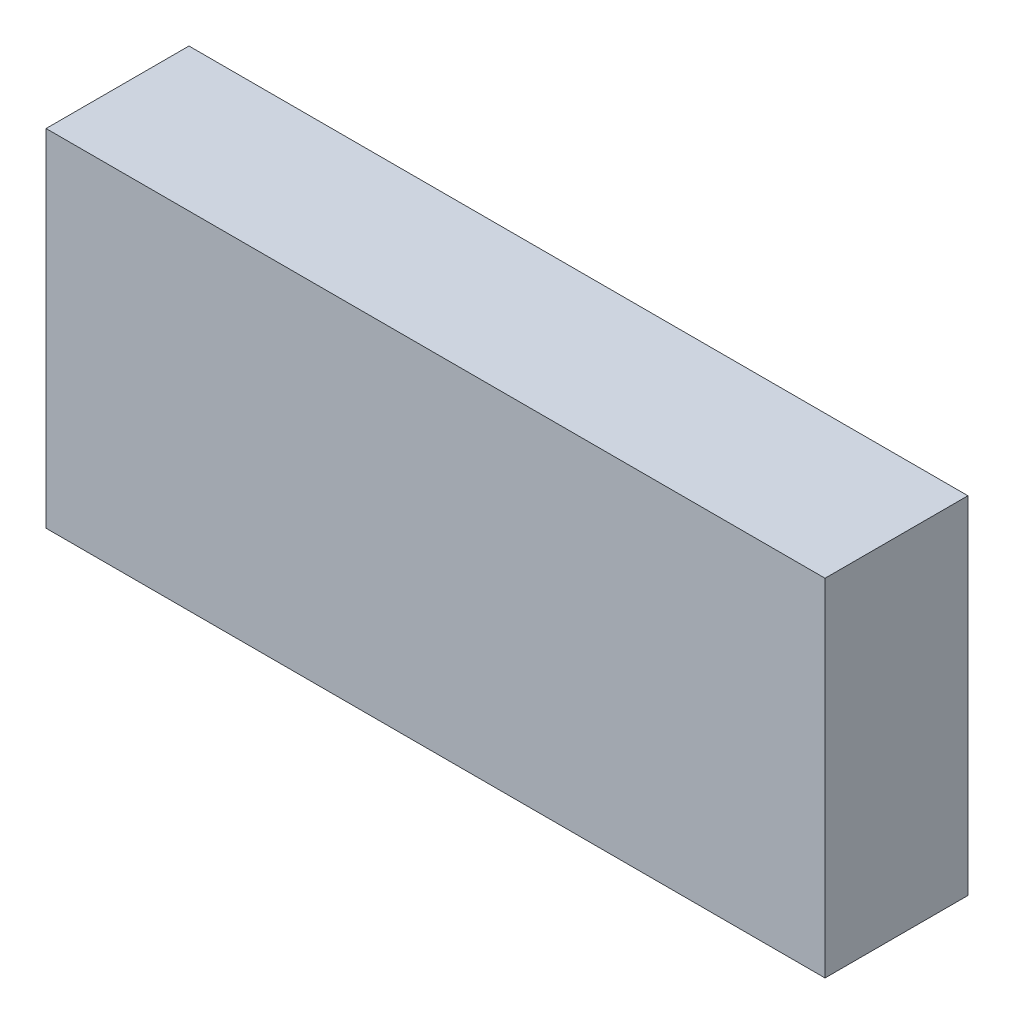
SolidWorks part; units mm, degrees
ref_plane "Front Plane" through (0, 0, 0) normal (0, 0, 1) x (1, 0, 0)
ref_plane "Top Plane" through (0, 0, 0) normal (0, 1, 0) x (1, 0, 0)
ref_plane "Right Plane" through (0, 0, 0) normal (1, 0, 0) x (0, 0, -1)
sketch "Sketch1" plane through (0, 0, 0) normal (0, 0, 1) x (1, 0, 0)
  line L0 (-0.9, 0.4) -> (0.9, 0.4)
  line L1 (0.9, 0.4) -> (0.9, -0.4)
  line L2 (0.9, -0.4) -> (-0.9, -0.4)
  line L3 (-0.9, -0.4) -> (-0.9, 0.4)
extrude "Component_Outline" add sketch "Sketch1" along normal blind 0.3302 separate body
